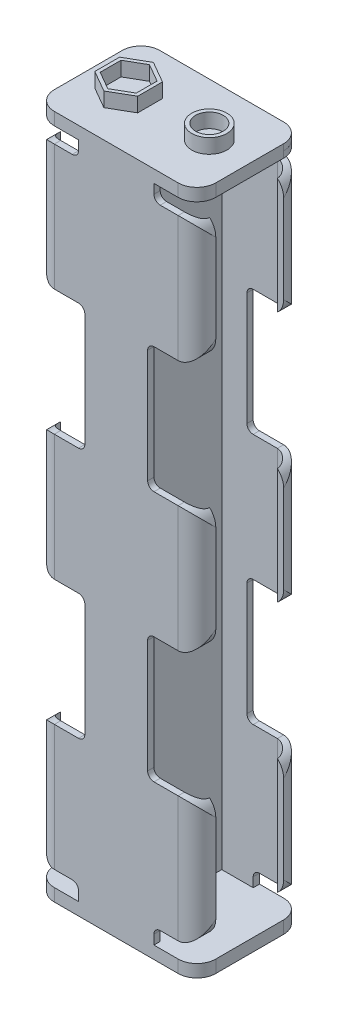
SolidWorks part; units mm, degrees
ref_plane "Plan de face" through (0, 0, 0) normal (0, 0, 1) x (1, 0, 0)
ref_plane "Plan de dessus" through (0, 0, 0) normal (0, 1, 0) x (1, 0, 0)
ref_plane "Plan de droite" through (0, 0, 0) normal (1, 0, 0) x (0, 0, -1)
sketch "Esquisse1" plane through (0, 0, 0) normal (0, 1, 0) x (1, 0, 0)
  line L0 (-2.9306, 0) -> (35.2542, 0) construction
  line L1 (3, 0) -> (12.85, 0)
  line L2 (0, 3) -> (0, 13.8)
  line L3 (3, 16.8) -> (12.85, 16.8)
  line L5 (-2.9306, 16.8) -> (35.2542, 16.8) construction
  line L6 (25.7, -1.1537) -> (25.7, 23.0004) construction
  line L7 (0, -1.1537) -> (0, 23.0004) construction
  line L8 (12.85, 23.0004) -> (12.85, -1.1537) construction
  line L9 (12.85, 16.8) -> (12.85, 0)
  arc A0 (0, 13.8) -> (3, 16.8) centre (3, 13.8) cw
  arc A1 (3, 0) -> (0, 3) centre (3, 3) cw
  dimension "D1" = 3
  dimension "D2" = 25.7
  dimension "D3" = 12.85
extrude "Extrusion1" add sketch "Esquisse1" along normal blind 107
shell "Coque2" thickness 1
sketch "Esquisse2" plane through (0, 0, -16.8) normal (0, 0, -1) x (-1, 0, 0)
  line L0 (28.4351, 0) -> (-17.3503, 0) construction
  line L1 (-12.85, -3.5241) -> (-12.85, 111.9911) construction
  line L2 (-7.85, -3.5241) -> (-7.85, 81.8799) construction
  line L3 (-17.3503, 53.5) -> (28.4351, 53.5) construction
  line L4 (-11.4284, 1) -> (13.7838, 1) construction
  line L5 (-11.4284, 3.5) -> (13.7838, 3.5) construction
  line L6 (-11.4284, 23.5) -> (13.7838, 23.5) construction
  line L7 (-11.4284, 43.5) -> (13.7838, 43.5) construction
  line L8 (-6.85, -3.5241) -> (-6.85, 8.1127) construction
  line L9 (0, -3.5241) -> (0, 62.7391) construction
  line L10 (-5.85, 3.5) -> (-3, 3.5)
  line L11 (0, 6.5) -> (0, 20.5)
  line L12 (-3, 23.5) -> (-6.85, 23.5)
  line L13 (-7.85, 24.5) -> (-7.85, 42.5)
  line L14 (-6.85, 43.5) -> (-3, 43.5)
  line L15 (0, 46.5) -> (0, 60.5)
  line L16 (-6.85, 63.5) -> (-3, 63.5)
  line L17 (-6.85, 2.5) -> (-6.85, 1)
  line L18 (-6.85, 1) -> (2.3677, 1)
  line L19 (2.3677, 106) -> (2.3677, 1)
  line L20 (-7.85, 82.5) -> (-7.85, 64.5)
  line L21 (-3, 83.5) -> (-6.85, 83.5)
  line L22 (0, 100.5) -> (0, 86.5)
  line L23 (-5.85, 103.5) -> (-3, 103.5)
  line L24 (-6.85, 104.5) -> (-6.85, 106)
  line L25 (-6.85, 106) -> (2.3677, 106)
  line L27 (-15.4722, 107) -> (16.041, 107) construction
  arc A0 (0, 100.5) -> (-3, 103.5) centre (-3, 100.5) ccw
  arc A1 (-3, 83.5) -> (0, 86.5) centre (-3, 86.5) ccw
  arc A2 (0, 20.5) -> (-3, 23.5) centre (-3, 20.5) ccw
  arc A3 (-3, 3.5) -> (0, 6.5) centre (-3, 6.5) ccw
  arc A4 (-3, 43.5) -> (0, 46.5) centre (-3, 46.5) ccw
  arc A5 (-3, 63.5) -> (0, 60.5) centre (-3, 60.5) cw
  arc A6 (-7.85, 82.5) -> (-6.85, 83.5) centre (-6.85, 82.5) cw
  arc A7 (-6.85, 63.5) -> (-7.85, 64.5) centre (-6.85, 64.5) cw
  arc A8 (-7.85, 42.5) -> (-6.85, 43.5) centre (-6.85, 42.5) cw
  arc A9 (-6.85, 23.5) -> (-7.85, 24.5) centre (-6.85, 24.5) cw
  arc A10 (-5.85, 3.5) -> (-6.85, 2.5) centre (-5.85, 2.5) ccw
  arc A11 (-5.85, 103.5) -> (-6.85, 104.5) centre (-5.85, 104.5) cw
  point P28 (0, 53.5)
  point P41 (0, 103.5)
  point P44 (0, 83.5)
  point P47 (0, 23.5)
  point P50 (0, 3.5)
  point P53 (0, 43.5)
  point P56 (0, 63.5)
  point P59 (-7.85, 83.5)
  point P62 (-7.85, 63.5)
  point P65 (-7.85, 43.5)
  point P68 (-7.85, 23.5)
  point P71 (-6.85, 3.5)
  point P74 (-6.85, 103.5)
  dimension "D8" = 3
  dimension "D9" = 3
  dimension "D10" = 1
  dimension "D1" = 53.5
  dimension "D2" = 5
  dimension "D3" = 1
  dimension "D4" = 2.5
  dimension "D5" = 20
  dimension "D6" = 20
  dimension "D7" = 6
extrude "Enlèv. mat.-Extru.1" cut sketch "Esquisse2" against normal through all
sketch "Esquisse3" plane through (0, 107, 0) normal (0, 1, 0) x (-1, 0, 0)
  line L1 (-12.85, 0) -> (-3, 0)
  line L2 (-12.85, 0) -> (-12.85, -16.7952)
  line L3 (-12.85, -16.7952) -> (-3, -16.7952)
  line L4 (0, -3) -> (0, -13.7952)
  arc A0 (-3, 0) -> (0, -3) centre (-3, -3) cw
  arc A1 (-3, -16.7952) -> (0, -13.7952) centre (-3, -13.7952) ccw
  dimension "D1" = 3
extrude "Extrusion2" add sketch "Esquisse3" along normal blind 1
sketch "Esquisse4" plane through (0, 0, 0) normal (0, -1, 0) x (1, 0, 0)
  line L1 (12.85, -16.8) -> (3, -16.8)
  line L2 (12.85, -16.8) -> (12.85, 0)
  line L3 (12.85, 0) -> (3, 0)
  line L4 (0, -13.8) -> (0, -3)
  arc A0 (3, 0) -> (0, -3) centre (3, -3) ccw
  arc A1 (3, -16.8) -> (0, -13.8) centre (3, -13.8) cw
  dimension "D1" = 3
extrude "Extrusion3" add sketch "Esquisse4" along normal blind 1
mirror "Symétrie2" about plane through (12.85, 107, -16.8) normal (-1, 0, 0) of "Extrusion1", "Coque2", "Enlèv. mat.-Extru.1", "Extrusion2", "Extrusion3"
sketch "Esquisse5" plane through (0, 108, 0) normal (0, 1, 0) x (-1, 0, 0)
  line L0 (3.0229, 0) -> (-31.3419, 0) construction
  line L1 (0, 4.1066) -> (0, -22.6216) construction
  line L2 (3.0229, -8.4) -> (-31.3419, -8.4) construction
  line L3 (-12.85, 4.1066) -> (-12.85, -22.6216) construction
  line L5 (-6.425, -12.3412) -> (-3.0118, -10.3706)
  line L6 (-6.425, 4.1066) -> (-6.425, -13.3427) construction
  line L7 (-3.0118, -10.3706) -> (-3.0118, -6.4294)
  line L8 (-3.0118, -6.4294) -> (-6.425, -4.4588)
  line L9 (-6.425, -4.4588) -> (-9.8382, -6.4294)
  line L10 (-9.8382, -6.4294) -> (-9.8382, -10.3706)
  line L11 (-9.8382, -10.3706) -> (-6.425, -12.3412)
  line L12 (-6.425, -11.7155) -> (-3.5537, -10.0577)
  line L13 (-3.5537, -10.0577) -> (-3.5537, -6.7423)
  line L14 (-3.5537, -6.7423) -> (-6.425, -5.0845)
  line L15 (-6.425, -5.0845) -> (-9.2963, -6.7423)
  line L16 (-9.2963, -6.7423) -> (-9.2963, -10.0577)
  line L17 (-9.2963, -10.0577) -> (-6.425, -11.7155)
  circle A0 centre (-6.425, -8.4) radius 2.8 construction
  circle A1 centre (-19.275, -8.4) radius 2.8
  circle A2 centre (-6.425, -8.4) radius 3.4132 construction
  circle A3 centre (-6.425, -8.4) radius 2.8713 construction
  circle A4 centre (-19.275, -8.4) radius 2.2
  dimension "D1" = 8.4
  dimension "D2" = 12.85
  dimension "D3" = 6.425
extrude "Extrusion4" add sketch "Esquisse5" along normal blind 2.3
